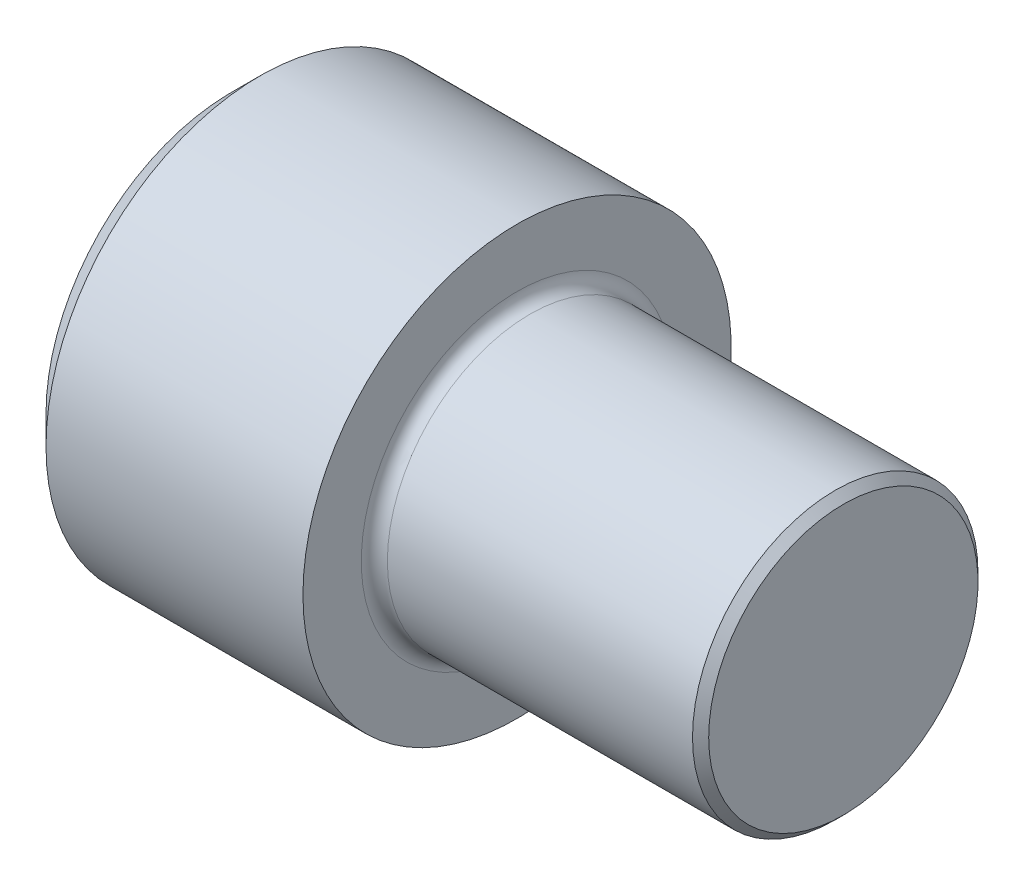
SolidWorks part; units mm, degrees
revolve "Base-Revolve" add sketch "BodySke"
sketch "BodySke" plane through (0, 0, 0) normal (0, 0, 1) x (1, 0, 0)
  line L0 (0, 0) -> (0, 28.8925)
  line L1 (4.445, 33.3375) -> (44.45, 33.3375)
  line L2 (44.45, 33.3375) -> (44.45, 22.225)
  line L3 (44.45, 22.225) -> (93.9902, 22.225)
  line L4 (95.25, 20.9652) -> (95.25, 0)
  line L5 (95.25, 0) -> (0, 0)
  line L6 (-31.75, 0) -> (127, 0) construction
  line L7 (0, 28.8925) -> (4.445, 33.3375)
  line L8 (95.25, 20.9652) -> (93.9902, 22.225)
  line L9 (0, -28.8925) -> (4.445, -33.3375) construction
  line L10 (95.25, -20.9652) -> (93.9902, -22.225) construction
  line L11 (46.5658, 9.525) -> (46.5658, 3.175) construction
  line L12 (44.45, 9.525) -> (44.45, 3.175) construction
  line L13 (57.15, 9.525) -> (57.15, 3.175) construction
  dimension "Diameter" = 44.45
  dimension "Head_ht" = 44.45
  dimension "Length" = 50.8
  dimension "Body_ch_ang" = 45
  dimension "Head_dia" = 66.675
  dimension "Head_ch_ang" = 45
  dimension "Head_side_ht" = 40.005
  dimension "Minor_dia" = 41.9303
  dimension "Advance" = 2.1158
  dimension "Thread_nom" = 50.8
  dimension "Thread_length" = 38.1
fillet "Fillet1" radius 2.032 1 edges at (44.45, 0, 22.225)
ref_plane "Plane1" through (0, 0, 0) normal (0, 0, 1) x (1, 0, 0)
ref_plane "Plane2" through (0, 0, 0) normal (0, 1, 0) x (1, 0, 0)
ref_plane "Plane3" through (0, 0, 0) normal (1, 0, 0) x (0, 0, -1)
other "Configuration Table"
sketch "Sketch2" plane through (0, 0, 0) normal (0, 0, 1) x (1, 0, 0)
  line L0 (0, 15.875) -> (22.098, 15.875)
  line L1 (22.098, 15.875) -> (31.2634, 0)
  line L2 (-31.75, 0) -> (127, 0) construction
  line L3 (31.2634, 0) -> (0, 0)
  line L4 (0, 0) -> (0, 15.875)
  line L5 (0, 28.8925) -> (0, -28.8925) construction
  line L6 (0, 0) -> (47.625, 0) construction
  line L7 (44.45, -33.3375) -> (44.45, 33.3375) construction
revolve "Hex-PreBroach" cut sketch "Sketch2" angle 360 about L6
sketch "Sketch3" plane through (0, 0, 0) normal (-1, 0, 0) x (0, 0.5, 0.866)
  line L0 (9.1654, 15.875) -> (-9.1654, 15.875)
  line L1 (-9.1654, 15.875) -> (-18.3309, 0)
  line L2 (9.1654, 15.875) -> (18.3309, 0)
  line L3 (9.1654, -15.875) -> (18.3309, 0)
  line L4 (9.1654, -15.875) -> (-9.1654, -15.875)
  line L5 (-9.1654, -15.875) -> (-18.3309, 0)
extrude "Hex" cut sketch "Sketch3" against normal blind 22.098
sketch "Sketch4" plane through (0, 0, 0) normal (-1, 0, 0) x (0, 0, 1)
  line L0 (0, 0) -> (10.1727, 0)
  line L1 (0, 0) -> (6.1484, 3.5498) construction
  line L2 (0, 0) -> (5.0863, 8.8098)
  line L3 (8.4417, 2.1022) -> (9.7612, 2.864)
  line L4 (6.0414, 6.2596) -> (7.3609, 7.0215)
  arc A0 (8.4417, 2.1022) -> (6.0414, 6.2596) centre (0, 0) ccw
  arc A1 (10.1727, 0) -> (9.7612, 2.864) centre (0, 0) ccw
  arc A2 (5.0863, 8.8098) -> (7.3609, 7.0215) centre (0, 0) cw
extrude "Spline" [suppressed] cut sketch "Sketch4" against normal blind 22.098
pattern_circular "CirPattern1" [suppressed] count 6 every 60
sketch "Sketch5" plane through (0, 0, 0) normal (0, 0, 1) x (1, 0, 0)
  line L0 (-31.75, 0) -> (127, 0) construction
  line L2 (0, 28.8925) -> (0, -28.8925) construction
  circle A0 centre (11.684, 0) radius 1.524
  dimension "Drilled_hole_dia" = 3.048
  dimension "Drilled_hole_loc" = 11.684
extrude "Hole" [suppressed] cut sketch "Sketch5" against normal through all and the other way through all
pattern_circular "Drilled-4" [suppressed] count 2 every 60
pattern_circular "Drilled-6" [suppressed] count 3 every 60
sketch "ThdSchSke" plane through (0, 0, 0) normal (0, 0, 1) x (1, 0, 0)
  line L0 (46.5658, -20.9652) -> (45.6837, -22.225)
  line L1 (46.5658, -20.9652) -> (47.448, -22.225)
  line L2 (47.448, -22.225) -> (47.448, -27.7812)
  line L3 (-3.175, 0) -> (5.1513, 0) construction
  line L5 (47.448, -27.7812) -> (45.6837, -27.7812)
  line L6 (45.6837, -27.7812) -> (45.6837, -22.225)
  line L7 (0, 28.8925) -> (0, -28.8925) construction
revolve "ThreadSchematic" [suppressed] cut sketch "ThdSchSke" angle 360 about L3
pattern_linear "ThdSchPat" [suppressed]
equation "\"D2@Sketch3\" = \"Hex_size@Sketch3\" / 2"
equation "\"D1@Sketch3\" = \"Hex_size@Sketch3\" / 2"
equation "\"D1@Sketch2\" = \"Hex_size@Sketch3\" / 2"
equation "\"D3@Sketch4\" = \"Spline_p_dim@Sketch4\" / 2"
equation "\"Thread_minor@ThreadCosmetic\"  =  \"Minor_dia@BodySke\""
equation "\"D2@CirPattern1\" = 360 / \"Num_teeth@CirPattern1\""
equation "\"Wall_thickness@Sketch2\" = \"Head_ht@BodySke\" - \"Key_eng@Hex\""
equation "\"Thread_length@ThreadCosmetic\" = ((sgn( (\"Length@BodySke\" - \"Advance@BodySke\" ) - \"Thread_nom@BodySke\" )-1)*( (\"Length@BodySke\" - \"Advance@BodySke\" ) - \"Thread_nom@BodySke\" ))/-2+ \"Thread_nom@BodySke\""
equation "\"Thread_minor@ThdSchSke\" = \"Minor_dia@BodySke\""
equation "\"Diameter@ThdSchSke\" = \"Diameter@BodySke\""
equation "\"Overcut@ThdSchSke\" = \"Diameter@BodySke\" * 1.25"
equation "\"Start@ThdSchSke\" = \"Head_ht@BodySke\" + \"Length@BodySke\" - \"Thread_length@ThreadCosmetic\"  '---Non-countersunk---"
equation "\"Num_threads@ThdSchPat\" = int( \"Thread_length@ThreadCosmetic\" / \"Advance@BodySke\" + 0.999 )  + 1"
equation "\"Advance@ThdSchPat\" = \"Thread_length@ThreadCosmetic\" /  (\"Num_threads@ThdSchPat\" - 1) 'relax it"
equation "\"Num_threads@ThdSchPat\" = \"Num_threads@ThdSchPat\" - sgn( \"Num_threads@ThdSchPat\" - 1) '---chamfered tips only---"
